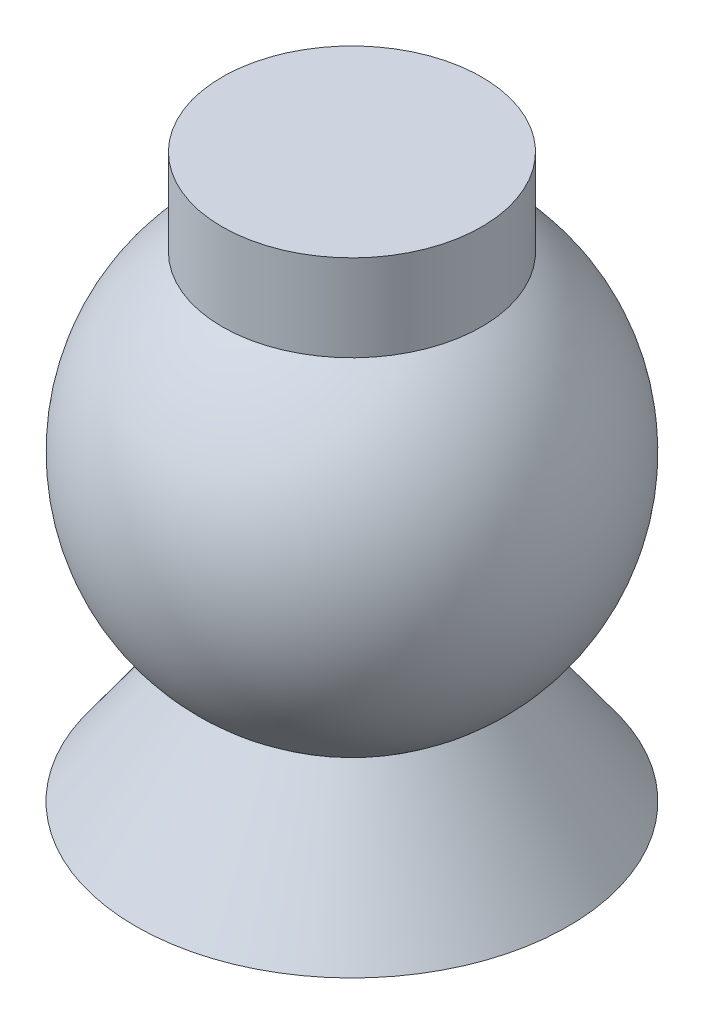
SolidWorks part; units mm, degrees
ref_plane "前视基准面" through (0, 0, 0) normal (0, 0, 1) x (1, 0, 0)
ref_plane "上视基准面" through (0, 0, 0) normal (0, 1, 0) x (1, 0, 0)
ref_plane "右视基准面" through (0, 0, 0) normal (1, 0, 0) x (0, 0, -1)
sketch "草图1" plane through (0, 0, 0) normal (0, 0, 1) x (1, 0, 0)
  line L0 (0, 28.658) -> (0, -30.4398) construction
  line L1 (0, 12) -> (-6, 12)
  line L2 (-6, 12) -> (-6, 8)
  line L3 (-5.8124, -8.1373) -> (-10, -14)
  line L4 (-10, -14) -> (0, -14)
  line L5 (0, -14) -> (0, 12)
  arc A0 (-6, 8) -> (-5.8124, -8.1373) centre (0, 0) ccw
  dimension "D1" = 10
  dimension "D2" = 6
  dimension "D3" = 4
  dimension "D4" = 10
  dimension "D5" = 14
revolve "旋转1" add sketch "草图1" angle 360 about L0
